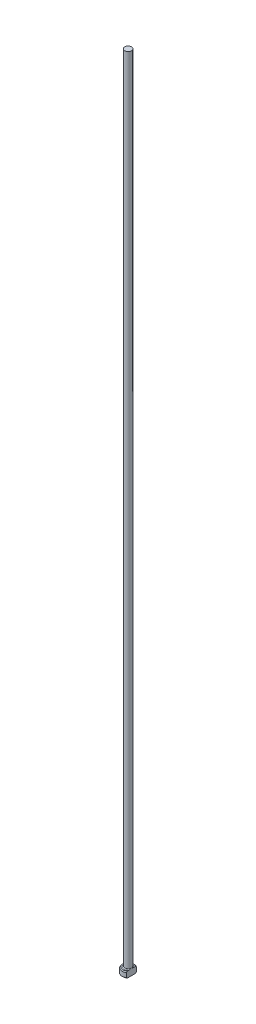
SolidWorks part; units mm, degrees
ref_plane "Front Plane" through (0, 0, 0) normal (0, 0, 1) x (1, 0, 0)
ref_plane "Top Plane" through (0, 0, 0) normal (0, 1, 0) x (1, 0, 0)
ref_plane "Right Plane" through (0, 0, 0) normal (1, 0, 0) x (0, 0, -1)
sketch "Sketch1" plane through (0, 0, 0) normal (0, 0, 1) x (1, 0, 0)
  line L0 (0, 259.9588) -> (0, -15.1925) construction
  line L1 (0, 0) -> (-1.5, 0)
  line L2 (-1.5, 0) -> (-1.5, 1.5)
  line L3 (-1.5, 1.5) -> (-0.85, 1.5)
  line L4 (-0.85, 1.5) -> (-0.85, 200)
  line L5 (-0.85, 200) -> (0, 200)
  line L6 (0, 200) -> (0, 0)
  dimension "L" = 200
  dimension "H" = 3
  dimension "T" = 1.5
  dimension "D" = 1.7
revolve "Revolve1" add sketch "Sketch1" angle 360 about L0
chamfer "Chamfer1" distance 0.2 angle 45 2 edges at (0, 1.5, 1.5) (0, 0, 1.5)
fillet "Fillet1" radius 0.2 1 edges at (0, 1.5, 0.85)
sketch "Sketch2" plane through (0, 0, 0) normal (0, 1, 0) x (1, 0, 0)
  line L0 (0.85, 1.2359) -> (0.85, -1.2359)
  circle A0 centre (0, 0) radius 1.5 construction
  arc A1 (0.85, -1.2359) -> (0.85, 1.2359) centre (0, 0) ccw
  circle A2 centre (0, 0) radius 0.85 construction
extrude "KEY" cut sketch "Sketch2" along normal through all
